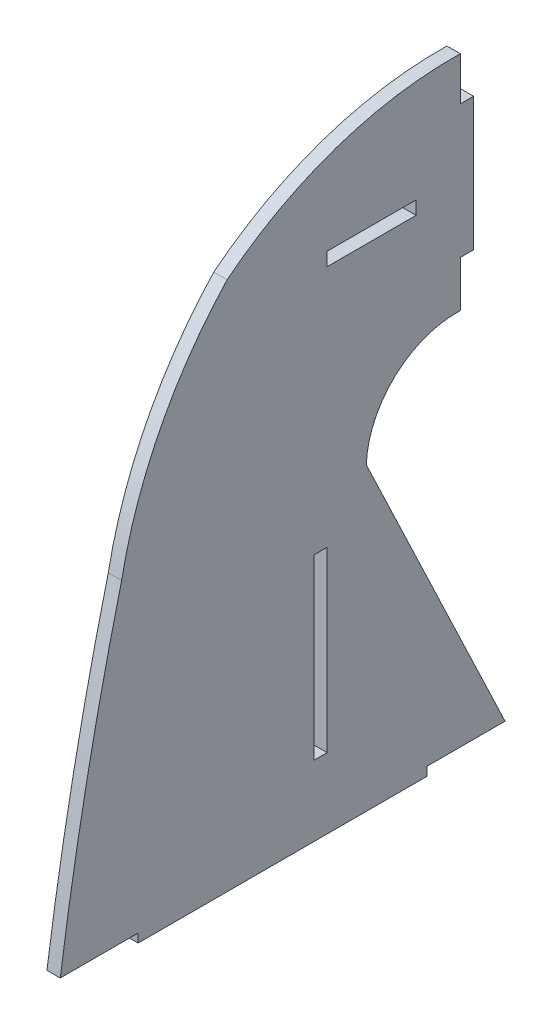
SolidWorks part; units mm, degrees
ref_plane "Plan de face" through (0, 0, 0) normal (0, 0, 1) x (1, 0, 0)
ref_plane "Plan de dessus" through (0, 0, 0) normal (0, 1, 0) x (1, 0, 0)
ref_plane "Plan de droite" through (0, 0, 0) normal (1, 0, 0) x (0, 0, -1)
sketch "Esquisse1" plane through (0, 0, 0) normal (1, 0, 0) x (0, 0, -1)
  line L0 (-81.9444, -27.5) -> (89.8148, -27.5) construction
  line L1 (-50, -137.5) -> (-32.5, -137.5)
  line L5 (39.9326, -52.5391) -> (39.9326, -42.1755)
  line L7 (18.785, -71.9485) -> (50, -137.5)
  line L13 (42.9326, -42.1755) -> (42.9326, -12.2755)
  line L14 (10, -26) -> (30, -26)
  line L15 (10, -26) -> (10, -29)
  line L16 (10, -29) -> (30, -29)
  line L17 (30, -26) -> (30, -29)
  line L18 (10, -26) -> (30, -29) construction
  line L19 (10, -29) -> (30, -26) construction
  line L25 (39.9326, -12.2755) -> (42.9326, -12.2755)
  line L26 (39.9326, -42.1755) -> (42.9326, -42.1755)
  line L28 (10, -80.5217) -> (10, -157.3567) construction
  line L29 (0, -136.4557) -> (0, -127.9251) construction
  line L30 (32.5, -137.5) -> (50, -137.5)
  line L32 (-32.5, -137.5) -> (-32.5, -139.4557)
  line L33 (-32.5, -139.4557) -> (32.5, -139.4557)
  line L34 (32.5, -137.5) -> (32.5, -139.4557)
  line L35 (-32.5, -133.4557) -> (32.5, -139.4557) construction
  line L36 (-32.5, -139.4557) -> (32.5, -133.4557) construction
  line L37 (39.9326, -12.2755) -> (39.9326, -2.5)
  line L38 (10, -123.6193) -> (7, -123.6193)
  line L39 (10, -123.6193) -> (10, -83.6193)
  line L40 (10, -83.6193) -> (7, -83.6193)
  line L41 (7, -123.6193) -> (7, -83.6193)
  line L42 (42.9326, -52.5391) -> (42.9326, -2.5) construction
  line L44 (39.9326, -52.5391) -> (39.9326, -2.5) construction
  arc A4 (-36.2133, -67.0139) -> (-12.4881, -20.2909) centre (57.1585, -85.0416) cw
  arc A5 (-36.2133, -67.0139) -> (-50, -137.5) centre (623.2276, -232.5883) ccw
  arc A6 (39.9326, -2.5) -> (-12.4881, -20.2909) centre (38.4282, -84.1912) ccw
  arc A7 (39.9326, -52.5391) -> (18.785, -71.9485) centre (39.0635, -72.8176) ccw
  point P8 (20, -27.5)
  point P10 (-50, 72.5)
  point P12 (11.306, -56.2426)
  point P19 (39.9326, -27.2255)
  point P29 (10, -123.6193)
  point P40 (-27.1897, -40.1226)
  dimension "D1" = 100
  dimension "D2" = 25
  dimension "D3" = 110
  dimension "D4" = 40
  dimension "D5" = 29.9
  dimension "D6" = 3
  dimension "D8" = 20
  dimension "D9" = 3
  dimension "D14" = 6
  dimension "D15" = 65
  dimension "D16" = 3
  dimension "D17" = 40
extrude "Boss.-Extru.1" add sketch "Esquisse1" along normal blind 3
